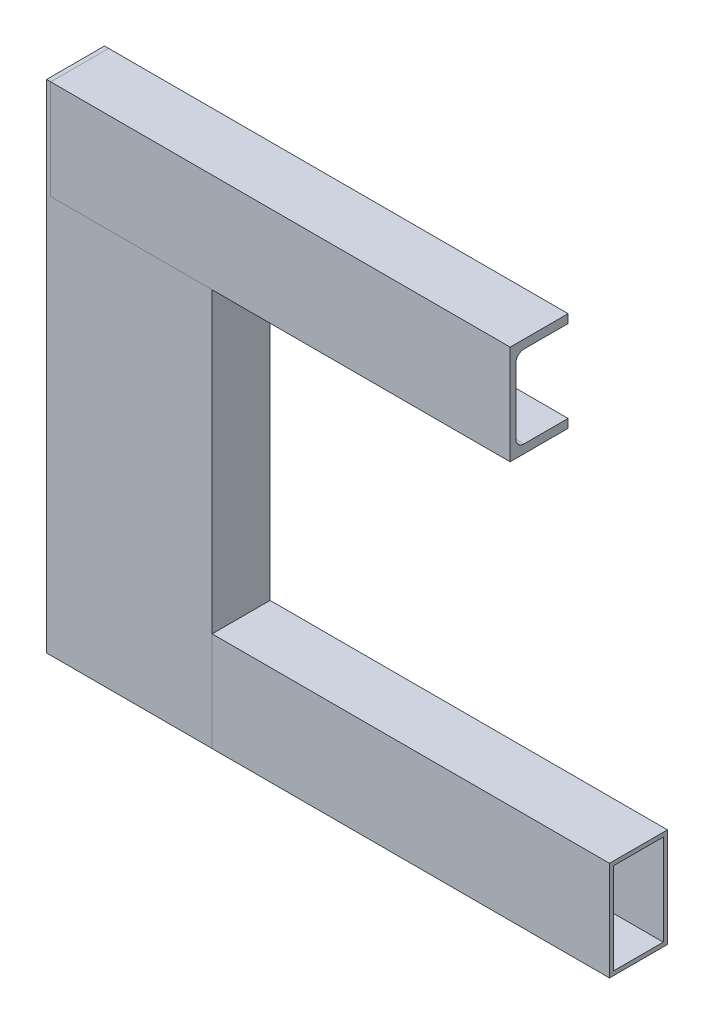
SolidWorks part; units mm, degrees
ref_plane "Front Plane" through (0, 0, 0) normal (0, 0, 1) x (1, 0, 0)
ref_plane "Top Plane" through (0, 0, 0) normal (0, 1, 0) x (1, 0, 0)
ref_plane "Right Plane" through (0, 0, 0) normal (1, 0, 0) x (0, 0, -1)
sketch "Sketch1" plane through (0, 0, 0) normal (0, 0, 1) x (1, 0, 0)
  line L0 (0, 0) -> (355.6, 0)
  line L1 (0, 0) -> (0, -381)
  line L2 (0, -381) -> (431.8, -381)
  dimension "D1" = 355.6
  dimension "D2" = 381
  dimension "D3" = 431.8
other "Structural Member1"
ref_plane "Plane1" through (0, 0, 0) normal (1, 0, 0) x (0, 1, 0)
sketch "Sketch123" plane through (0, -38.1, 0) normal (1, 0, 0) x (0, 0, -1)
  line L0 (0, 38.1) -> (0, -38.1)
  line L1 (0, 38.1) -> (44.45, 38.1)
  line L2 (4.318, 25.146) -> (4.318, -25.146)
  line L3 (0, 0) -> (69.2179, 0) construction
  line L4 (10.668, -31.496) -> (44.45, -31.496)
  line L5 (44.45, -38.1) -> (44.45, -31.496)
  line L6 (0, 0) -> (4.318, 0) construction
  line L7 (0, -38.1) -> (44.45, -38.1)
  line L15 (44.45, 38.1) -> (44.45, 31.496)
  line L17 (10.668, 31.496) -> (44.45, 31.496)
  arc A0 (4.318, -25.146) -> (10.668, -31.496) centre (10.668, -25.146) ccw
  arc A10 (4.318, 25.146) -> (10.668, 31.496) centre (10.668, 25.146) cw
  point P4 (44.45, 31.496)
  point P6 (2.159, 0)
  point P7 (22.225, 38.1)
  point P9 (22.225, -38.1)
  point P12 (44.45, -31.496)
  point P16 (0, 0)
  dimension "RI" = 6.35
  dimension "D2" = 44.45
  dimension "flange" = 6.604
  dimension "D1" = 4.318
  dimension "D3" = 38.1
other "Structural Member3"
ref_plane "Plane3" through (0, 0, 0) normal (0, -1, 0) x (1, 0, 0)
sketch "Sketch116" plane through (63.5, 0, 0) normal (0, -1, 0) x (0, 0, -1)
  line L0 (3.175, -60.325) -> (41.275, -60.325)
  line L1 (0, -63.5) -> (44.45, -63.5)
  line L2 (0, -63.5) -> (0, 63.5)
  line L3 (0, 0) -> (69.2179, 0) construction
  line L4 (0, 63.5) -> (44.45, 63.5)
  line L5 (44.45, -63.5) -> (44.45, 63.5)
  line L6 (41.275, -60.325) -> (41.275, 60.325)
  line L7 (3.175, 60.325) -> (41.275, 60.325)
  line L8 (3.175, -60.325) -> (3.175, 60.325)
  point P9 (0, 0)
  dimension "D2" = 127
  dimension "D1" = 44.45
  dimension "D3" = 3.175
other "Structural Member5"
ref_plane "Plane5" through (0, -381, 0) normal (1, 0, 0) x (0, 1, 0)
sketch "Sketch119" plane through (0, -381, -22.225) normal (1, 0, 0) x (0, 1, 0)
  line L0 (3.175, -19.05) -> (73.025, -19.05)
  line L1 (0, -22.225) -> (76.2, -22.225)
  line L2 (0, -22.225) -> (0, 22.225)
  line L3 (0, 0) -> (69.2179, 0) construction
  line L4 (0, 22.225) -> (76.2, 22.225)
  line L5 (76.2, -22.225) -> (76.2, 22.225)
  line L6 (73.025, -19.05) -> (73.025, 19.05)
  line L7 (3.175, 19.05) -> (73.025, 19.05)
  line L8 (3.175, -19.05) -> (3.175, 19.05)
  point P9 (0, 0)
  dimension "D2" = 44.45
  dimension "D1" = 76.2
  dimension "D3" = 3.175
sketch "Sketch126" plane through (0, 0, -44.45) normal (0, 0, -1) x (-1, 0, 0)
  line L0 (-3.175, 0) -> (-3.175, -76.2)
  line L1 (-3.175, -76.2) -> (-127, -76.2)
  line L2 (-127, -76.2) -> (-127, 0)
  line L3 (0, 0) -> (-355.6, 0) construction
  line L4 (-127, 0) -> (-3.175, 0)
  line L6 (-355.6, -76.2) -> (0, -76.2) construction
  line L7 (-127, -381) -> (-127, 0) construction
extrude "Extrude10" cut sketch "Sketch126" against normal through all
sketch "Sketch115" plane through (0, 0, -44.45) normal (0, 0, 1) x (1, 0, 0)
  line L2 (0, 0) -> (3.175, 0)
  line L3 (0, 0) -> (0, -76.2)
  line L4 (0, -76.2) -> (3.175, -76.2)
  line L5 (3.175, 0) -> (3.175, -76.2)
extrude "Extrude2" cut sketch "Sketch115" along normal through all
sketch "Sketch14" plane through (355.6, 0, 0) normal (1, 0, 0) x (0, 0, -1)
  circle A0 centre (152.2131, -38.1) radius 114.3
  dimension "D1" = 228.6
extrude "Extrude1" cut sketch "Sketch14" against normal through all
other "Trim/Extend4"
